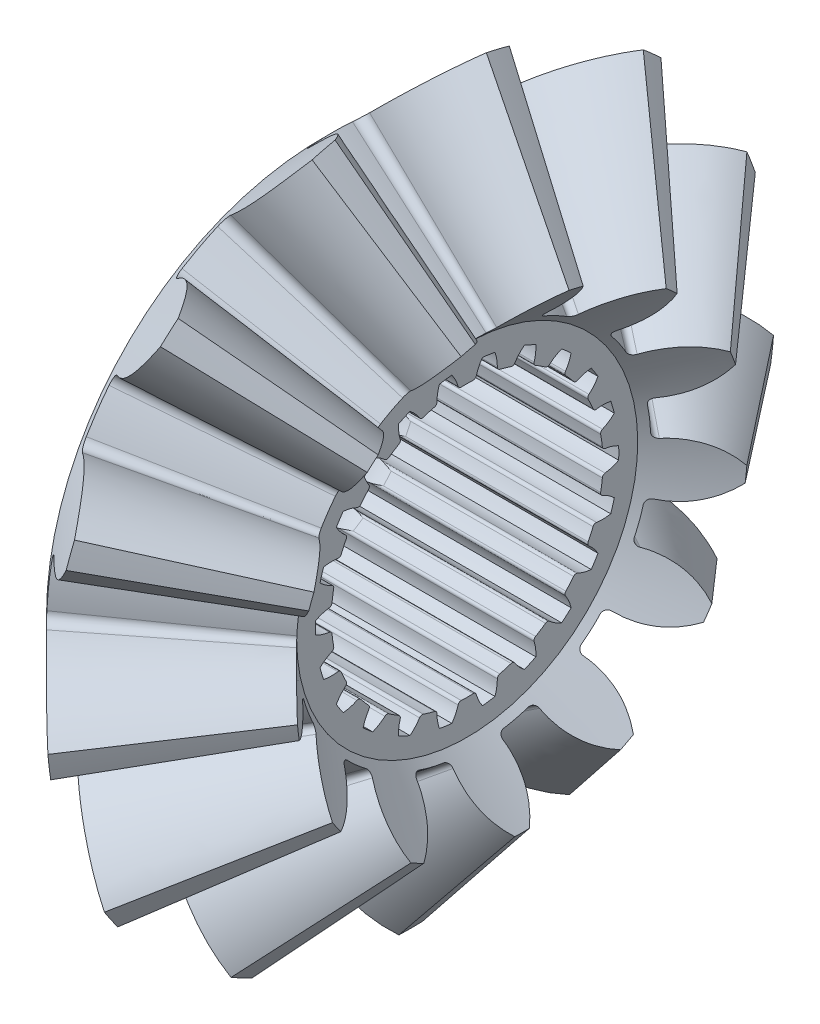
SolidWorks part; units mm, degrees
other "<Shaft>-<Fillet4>"
ref_plane "Front Plane" through (0, 0, 0) normal (0, 0, 1) x (1, 0, 0)
ref_plane "Top Plane" through (0, 0, 0) normal (0, 1, 0) x (1, 0, 0)
ref_plane "Right Plane" through (0, 0, 0) normal (1, 0, 0) x (0, 0, -1)
imported_body "straight miter gear_iso-2-solid1"
inserted part "Shaft"
move or copy body "Body-Move/Copy2" placed by mates yes parameters "D1"=0, "D2"=0, "D3"=0
combine bodies "Combine1" bodies to combine 101 102
